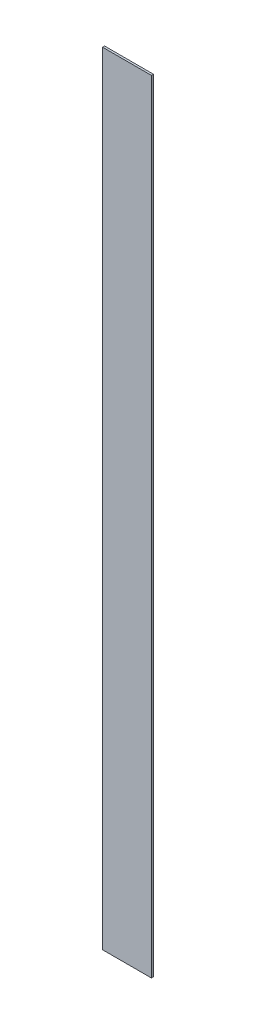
SolidWorks part; units mm, degrees
ref_plane "Front Plane" through (0, 0, 0) normal (1, 0, 0) x (0, 1, 0)
ref_plane "Top Plane" through (0, 0, 0) normal (0, 0, 1) x (0, 1, 0)
ref_plane "Right Plane" through (0, 0, 0) normal (0, 1, 0) x (-1, 0, 0)
sketch "Sketch1" plane through (0, 0, 0) normal (0, 0, 1) x (0, 1, 0)
  line L1 (-609.6, 38.1) -> (609.6, 38.1)
  line L2 (-609.6, 38.1) -> (-609.6, -38.1)
  line L3 (-609.6, -38.1) -> (609.6, -38.1)
  line L4 (609.6, 38.1) -> (609.6, -38.1)
  line L5 (-609.6, 38.1) -> (609.6, -38.1) construction
  line L6 (-609.6, -38.1) -> (609.6, 38.1) construction
  point P0 (0, 0)
  dimension "D1" = 76.2
  dimension "D2" = 1219.2
extrude "Boss-Extrude1" add sketch "Sketch1" along normal mid plane 3.175
